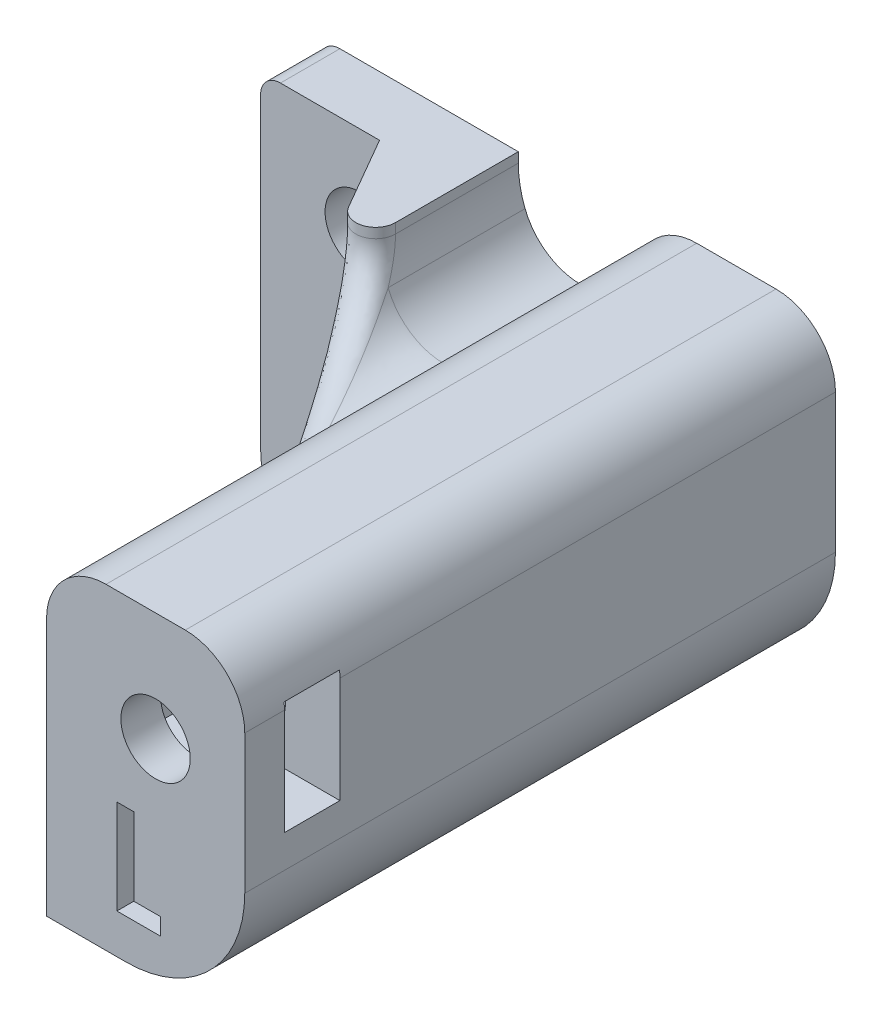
SolidWorks part; units mm, degrees
ref_plane "Front Plane" through (0, 0, 0) normal (0, 0, 1) x (1, 0, 0)
ref_plane "Top Plane" through (0, 0, 0) normal (0, 1, 0) x (1, 0, 0)
ref_plane "Right Plane" through (0, 0, 0) normal (1, 0, 0) x (0, 0, -1)
sketch "Sketch1" plane through (0, 0, 0) normal (0, 0, 1) x (1, 0, 0)
  line L1 (-5.5983, 15.5867) -> (4.4017, 15.5867)
  line L2 (-5.5983, 15.5867) -> (-5.5983, -5.4133)
  line L3 (-5.5983, -5.4133) -> (4.4017, -5.4133)
  line L4 (4.4017, 15.5867) -> (4.4017, -5.4133)
  circle A0 centre (-0.5983, 11.0867) radius 1.75
  circle A1 centre (-0.5983, -0.9133) radius 1.75
  point P8 (-0.5983, -5.4133)
  dimension "D3" = 3.5
  dimension "D4" = 3.5
  dimension "D1" = 10
  dimension "D2" = 4.5
  dimension "D5" = 5
  dimension "D6" = 5
  dimension "D7" = 12
  dimension "D8" = 4.5
extrude "Boss-Extrude1" add sketch "Sketch1" along normal blind 3
ref_plane "Plane1" through (0, 0, 3) normal (0, 0, 1) x (1, 0, 0)
sketch "Sketch2" plane through (0, 0, 3) normal (0, 0, 1) x (1, 0, 0)
  line L0 (-5.5983, 15.5867) -> (-5.5983, -5.4133) construction
  line L1 (-5.5983, 0.0867) -> (20.4017, 0.0867)
  line L2 (-5.5983, 0.0867) -> (-5.5983, 10.0867)
  line L3 (-5.5983, 10.0867) -> (10.4017, 10.0867)
  line L4 (20.4017, 0.0867) -> (20.4017, 16.0867)
  line L5 (-5.5983, -5.4133) -> (4.4017, -5.4133) construction
  line L6 (10.4017, 10.0867) -> (10.4017, 16.0867)
  line L7 (10.4017, 16.0867) -> (20.4017, 16.0867)
  dimension "D1" = 26
  dimension "D2" = 10
  dimension "D3" = 5.5
  dimension "D4" = 10
  dimension "D5" = 16
extrude "Extrude-Thin1" add sketch "Sketch2" along normal blind 26.8 thin
ref_plane "Plane2" through (0, 0, 29.8) normal (0, 0, 1) x (1, 0, 0)
sketch "Sketch10" plane through (0, 0, 29.8) normal (0, 0, 1) x (1, 0, 0)
  line L1 (-5.5983, 10.0867) -> (-5.5983, 0.0867) construction
  line L2 (-5.5983, 0.0867) -> (20.4017, 0.0867) construction
  line L3 (-5.5983, 0.0867) -> (20.4017, 0.0867)
  line L4 (-5.5983, 0.0867) -> (-5.5983, 10.0867)
  line L5 (20.4017, 0.0867) -> (20.4017, 16.0867) construction
  line L6 (-5.5983, 10.0867) -> (10.4017, 10.0867)
  line L7 (10.4017, 10.0867) -> (10.4017, 16.0867)
  line L10 (10.4017, 16.0867) -> (20.4017, 16.0867)
  line L11 (20.4017, 16.0867) -> (20.4017, 0.0867)
extrude "Boss-Extrude4" add sketch "Sketch10" against normal blind 7
ref_plane "Plane4" through (0, 0, 27.8) normal (0, 0, 1) x (1, 0, 0)
sketch "Sketch8" plane through (0, 0, 29.8) normal (0, 0, 1) x (1, 0, 0)
  circle A1 centre (-0.5983, 11.0867) radius 3.5
  circle A2 centre (-0.5983, -0.9133) radius 3.5
  dimension "D3" = 7
  dimension "D4" = 7
extrude "Cut-Extrude3" cut sketch "Sketch8" against normal up to surface (26.8 mm away)
sketch "Sketch13" plane through (0, 0, 29.8) normal (0, 0, 1) x (1, 0, 0)
  line L1 (20.4017, 0.0867) -> (20.4017, 16.0867) construction
  line L3 (2.7558, 0.0867) -> (20.4017, 0.0867) construction
  circle A0 centre (15.9017, 10.5867) radius 1.75
  dimension "D1" = 3.5
  dimension "D2" = 4.5
  dimension "D3" = 10.5
extrude "Cut-Extrude6" cut sketch "Sketch13" against normal blind 17.8
sketch "Sketch14" plane through (0, 0, 3) normal (0, 0, 1) x (1, 0, 0)
  line L0 (20.4017, 16.0867) -> (10.4017, 16.0867)
  line L1 (4.4017, 0.0867) -> (20.4017, 0.0867)
  line L2 (10.4017, 16.0867) -> (10.4017, 10.0867)
  line L3 (10.4017, 10.0867) -> (4.4017, 10.0867)
  line L4 (20.4017, 0.0867) -> (20.4017, 16.0867)
  line L5 (4.4017, 10.0867) -> (4.4017, 0.0867)
extrude "Boss-Extrude5" add sketch "Sketch14" against normal up to surface (3 mm away)
sketch "Sketch12" plane through (0, 0, 27.8) normal (0, 0, 1) x (1, 0, 0)
  line L0 (20.4017, 16.0867) -> (10.4017, 16.0867) construction
  line L1 (20.4017, 13.4367) -> (12.4017, 13.4367)
  line L2 (20.4017, 13.4367) -> (20.4017, 7.7367)
  line L3 (20.4017, 7.7367) -> (12.4017, 7.7367)
  line L4 (12.4017, 13.4367) -> (12.4017, 7.7367)
  line L6 (20.4017, 0.0867) -> (20.4017, 16.0867) construction
  dimension "D2" = 2.65
  dimension "D1" = 5.7
  dimension "D3" = 8
extrude "Cut-Extrude5" cut sketch "Sketch12" against normal blind 2.8
fillet "Fillet5" radius 4.5 2 edges at (4.4017, -5.4133, 1.5) (-5.5983, -5.4133, 1.5)
ref_plane "Plane5" through (0, 0, 29.8) normal (0, 0, 1) x (1, 0, 0)
sketch "Sketch15" plane through (0, 0, 29.8) normal (0, 0, 1) x (1, 0, 0)
  line L0 (-5.5983, 10.0867) -> (-5.5983, 0.0867) construction
  line L1 (10.4017, 0.0867) -> (-5.5983, 0.0867)
  line L2 (10.4017, 0.0867) -> (10.4017, 10.0867)
  line L3 (10.4017, 10.0867) -> (-5.5983, 10.0867)
  line L4 (-5.5983, 0.0867) -> (-5.5983, 10.0867)
  line L5 (2.7558, 0.0867) -> (20.4017, 0.0867) construction
extrude "Cut-Extrude7" cut sketch "Sketch15" against normal up to surface (26.8 mm away)
fillet "Fillet6" radius 5 2 edges at (4.4017, 0.0867, 1.5) (4.4017, 10.0867, 1.5)
chamfer "Chamfer1" distance 10 angle 60 2 edges at (10.4017, 1.1867, 3) (10.4017, 8.9867, 3)
fillet "Fillet7" radius 1.6 11 edges at (11.5017, 7.8867, 22.8) (14.3017, 2.2867, 22.8) (9.3017, 2.2867, 3) (6.5017, 7.8867, 3) (18.2017, 8.0867, 3) (18.2017, 2.2867, 12.9) (12.6017, 10.8867, 3) (15.4017, 13.8867, 3) (12.6017, 13.8867, 12.9) (18.2017, 13.8867, 12.9) (18.2017, 8.0867, 22.8)
fillet "Fillet8" radius 3 3 edges at (20.4017, 13.4367, 26.4) (20.4017, 16.0867, 14.9) (10.4017, 16.0867, 14.9)
fillet "Fillet9" radius 6 1 edges at (20.4017, 0.0867, 14.9)
fillet "Fillet10" radius 1 6 edges at (4.4017, 15.3367, 9.9282) (9.9017, 10.0867, 19.4545) (9.4601, 0.0867, 18.6896) (2.5301, -4.5659, 6.6866) (5.8662, 11.5512, 12.4647) (5.8284, -0.6986, 12.3993)
sketch "Sketch16" plane through (0, 0, 3) normal (0, 0, 1) x (1, 0, 0)
  circle A0 centre (-0.5983, 11.0867) radius 3.6
  circle A1 centre (-0.5983, -0.9133) radius 3.6
  dimension "D1" = 7.2
  dimension "D2" = 7.2
extrude "Cut-Extrude8" cut sketch "Sketch16" along normal blind 8
ref_plane "Plane6" through (0, 0, 29.8) normal (0, 0, 1) x (1, 0, 0)
sketch "Sketch17" plane through (0, 0, 29.8) normal (0, 0, 1) x (1, 0, 0)
  line L0 (13.4017, 2.0867) -> (17.4017, 2.0867) construction
  line L3 (17.4017, 16.0867) -> (13.4017, 16.0867) construction
  line L5 (20.4017, 6.0867) -> (20.4017, 13.0867) construction
  text T0 "L" font "Century Gothic" height in points 18
  dimension "D1" = 14
  dimension "D2" = 4
  dimension "D3" = 3
extrude "Cut-Extrude9" cut sketch "Sketch17" against normal blind 1
fillet "Fillet11" radius 3 7 edges at (10.4017, 11.5867, 0) (9.9017, 10.0867, 0) (9.4017, 10.0867, 8.2942) (10.4017, 8.4867, 20.3205) (10.4017, 10.0867, 9.1603) (9.9017, 10.0867, 17.4545) (10.4017, 9.7938, 19.7347)
fillet "Fillet12" radius 1 1 edges at (-5.5983, 15.5867, 1.5)
